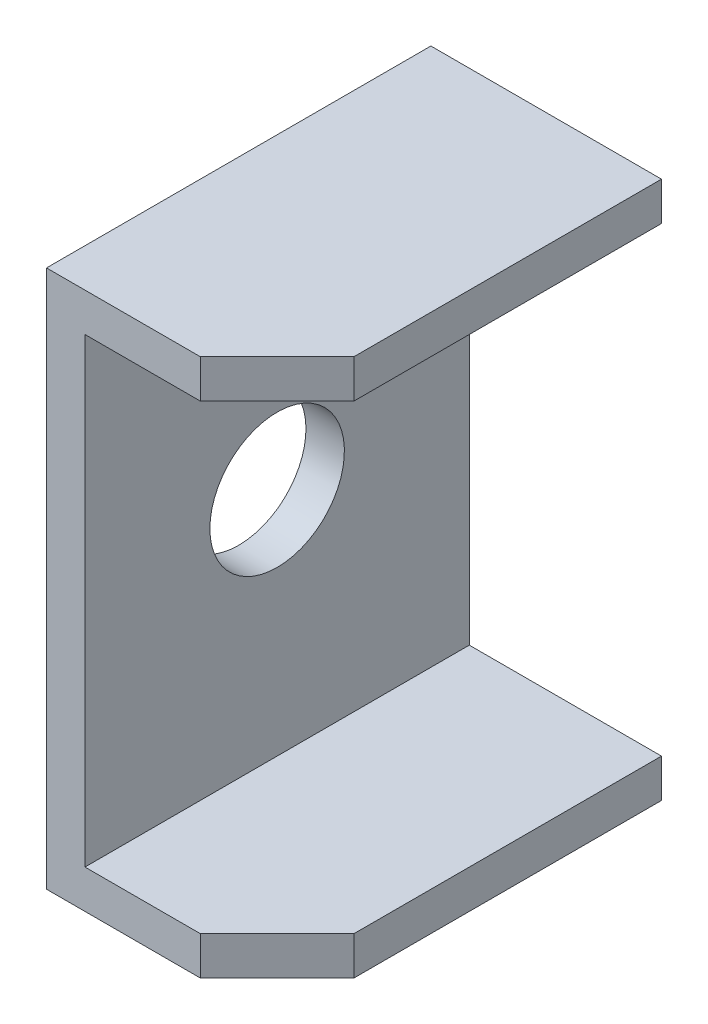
SolidWorks part; units mm, degrees
ref_plane "Face" through (0, 0, 0) normal (0, 0, 1) x (1, 0, 0)
ref_plane "Dessus" through (0, 0, 0) normal (0, 1, 0) x (1, 0, 0)
ref_plane "Droite" through (0, 0, 0) normal (1, 0, 0) x (0, 0, -1)
sketch "Esquisse1" plane through (0, 0, 0) normal (0, 0, 1) x (1, 0, 0)
  line L0 (0, 0) -> (60, 0)
  line L1 (0, 0) -> (0, -140)
  line L2 (0, -140) -> (60, -140)
  line L3 (60, -140) -> (60, -130)
  line L4 (60, -130) -> (10, -130)
  line L5 (10, -130) -> (10, -10)
  line L6 (10, -10) -> (60, -10)
  line L7 (60, -10) -> (60, 0)
  dimension "D1" = 60
  dimension "D2" = 140
  dimension "D3" = 10
  dimension "D4" = 10
extrude "Base-Extrusion" add sketch "Esquisse1" along normal blind 100
sketch "Esquisse2" plane through (0, 0, 0) normal (-1, 0, 0) x (0, 0, 1)
  line L0 (0, 0) -> (0, -140) construction
  line L1 (100, 0) -> (0, 0) construction
  circle A0 centre (50, -70) radius 17.5
  dimension "D1" = 35
  dimension "D2" = 50
  dimension "D3" = 70
extrude "Enlèv. mat.-Extru.1" cut sketch "Esquisse2" against normal blind 20
chamfer "Chanfrein1" distance 20 angle 45
